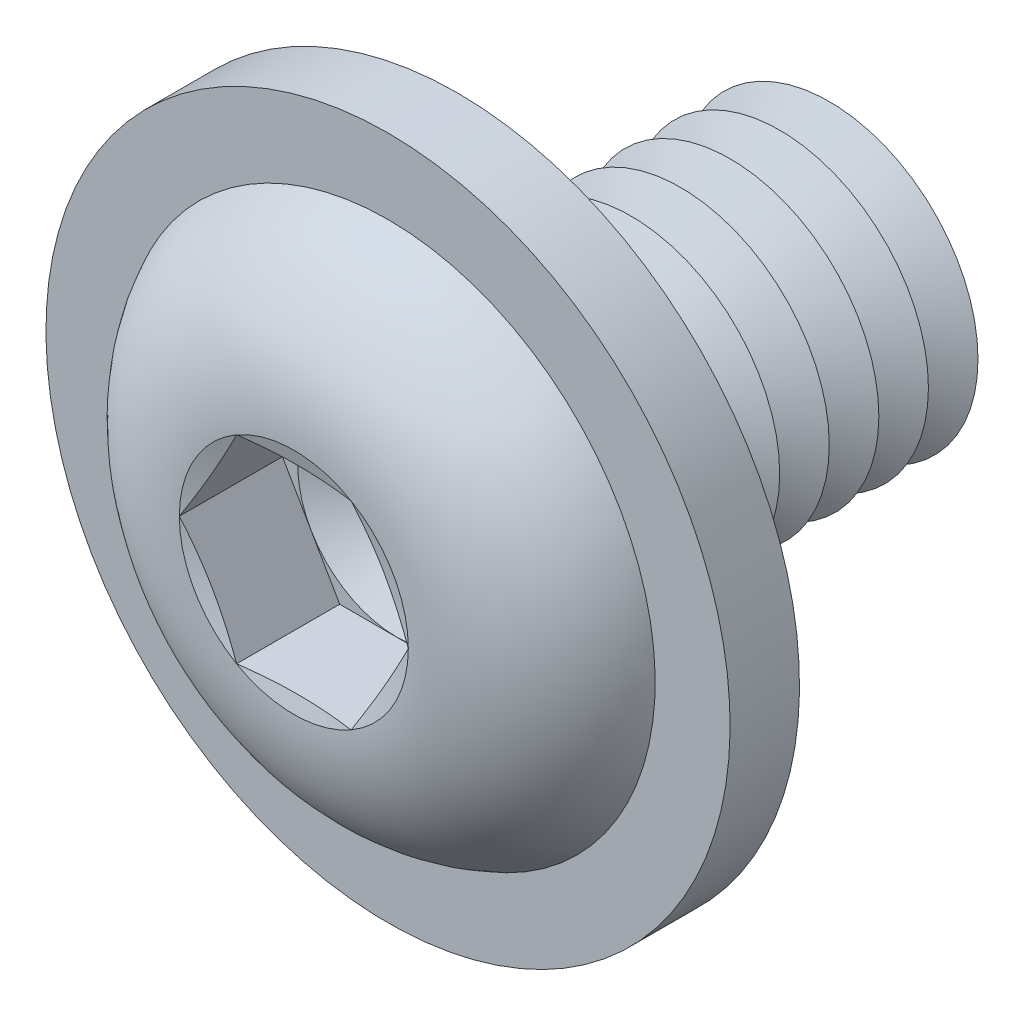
SolidWorks part; units mm, degrees
ref_plane "Front Plane" through (0, 0, 0) normal (0, 0, 1) x (1, 0, 0)
ref_plane "Top Plane" through (0, 0, 0) normal (0, 1, 0) x (1, 0, 0)
ref_plane "Right Plane" through (0, 0, 0) normal (1, 0, 0) x (0, 0, -1)
sketch "Sketch1" plane through (0, 0, 0) normal (1, 0, 0) x (0, 0, -1)
  line L0 (0, 1.5) -> (0, 2.85)
  line L3 (0, 1.5) -> (4, 1.5)
  line L4 (4, 1.5) -> (4, 0)
  line L5 (4, 0) -> (-1.65, 0) construction
  line L6 (-1.65, 0) -> (4, 0)
  line L7 (-1.65, 1.1547) -> (-1.65, 0.5773) construction
  line L8 (-1.65, 0.5773) -> (-1.65, 0)
  line L9 (-1.65, 1.1547) -> (-1.4953, 0.5773)
  line L10 (-1.4953, 0.5773) -> (-1.65, 0.5773)
  line L11 (4, 0) -> (22.7481, 0) construction
  line L12 (0, 2.85) -> (-1.65, 2.85) construction
  arc A1 (0, 2.85) -> (-1.65, 1.1547) centre (0, 1.1994) ccw
  point P8 (4, 0.75)
  dimension "D1" = 5.7
  dimension "D2" = 3
  dimension "D3" = 1.65
  dimension "D4" = 2.3094
  dimension "D5" = 4
  dimension "D6" = 15
revolve "Revolve1" add sketch "Sketch1" angle 360 about L5
fillet "Fillet1" radius 0.25 1 edges at (-1.5, 0, 0)
sketch "Sketch2" plane through (0, 0, 0) normal (1, 0, 0) x (0, 0, -1)
  line L0 (3.75, 1.5) -> (4.25, 1.5)
  line L1 (4, 1.5) -> (0.25, 1.5) construction
  line L2 (4.25, 1.5) -> (4, 1.067)
  line L3 (4, -1.5) -> (4, 1.5) construction
  line L4 (4, 1.067) -> (3.75, 1.5)
  dimension "D1" = 0.5
revolve "Cut-Revolve1" cut sketch "Sketch2" angle 360 about axis through (0, 0, -4) along (0, 0, -1)
pattern_linear "LPattern1" count 8 spacing 0.5 along (0, 0, 1) of "Cut-Revolve1"
sketch "Sketch3" plane through (0, 0, 1.65) normal (0, 0, 1) x (1, 0, 0)
  line L7 (0.5773, 1) -> (-0.5774, 1)
  line L8 (-0.5774, 1) -> (-1.1547, 0)
  line L9 (-1.1547, 0) -> (-0.5773, -1)
  line L10 (-0.5773, -1) -> (0.5773, -1)
  line L11 (0.5773, -1) -> (1.1547, 0)
  line L12 (1.1547, 0) -> (0.5773, 1)
  circle A0 centre (0, 0) radius 1 construction
  circle A3 centre (0, 0) radius 1.1547 construction
extrude "Cut-Extrude1" cut sketch "Sketch3" against normal blind 1.04
sketch "Sketch4" plane through (0, 0, 0.61) normal (0, 0, 1) x (1, 0, 0)
  line L1 (0.5773, 1) -> (-0.5774, 1) construction
  circle A0 centre (0, 0) radius 1
extrude "Cut-Extrude2" cut sketch "Sketch4" against normal through all draft 60
sketch "Sketch5" plane through (0, 0, 0) normal (0, 0, -1) x (-1, 0, 0)
  circle A0 centre (0, 0) radius 3.45
  circle A1 centre (0, 0) radius 1.75
  circle A2 centre (0, 0) radius 1.75 construction
  dimension "D1" = 6.9
extrude "Boss-Extrude1" add sketch "Sketch5" against normal blind 0.7
